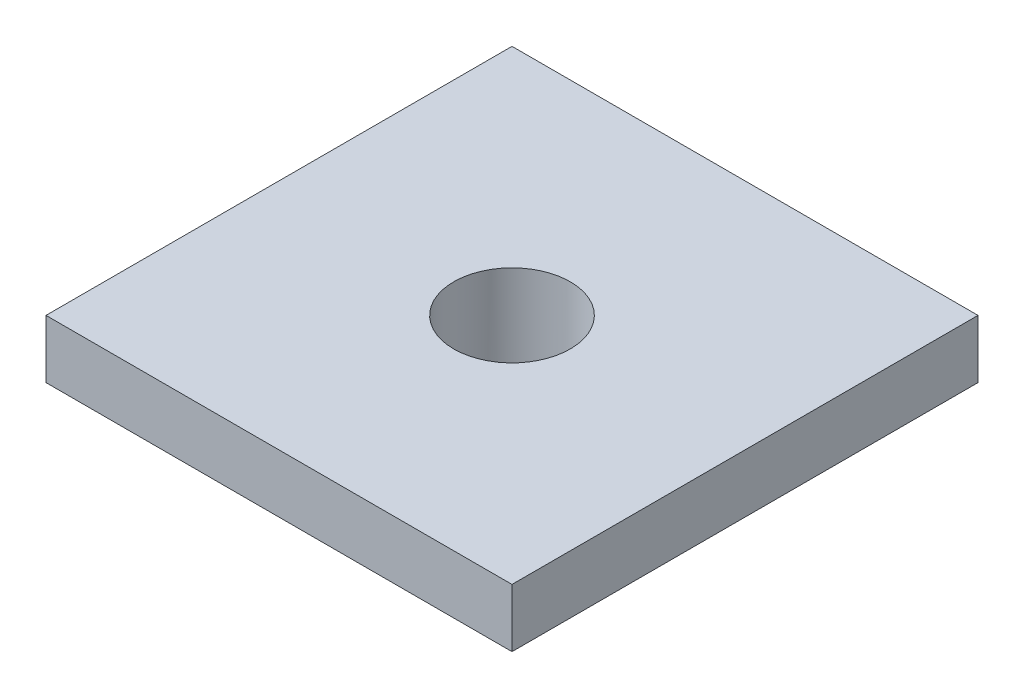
SolidWorks part; units mm, degrees
ref_plane "前视基准面" through (0, 0, 0) normal (0, 0, 1) x (1, 0, 0)
ref_plane "上视基准面" through (0, 0, 0) normal (0, 1, 0) x (1, 0, 0)
ref_plane "右视基准面" through (0, 0, 0) normal (1, 0, 0) x (0, 0, -1)
other "Configuration Table"
sketch "Sk1" plane through (0, 0, 0) normal (0, 1, 0) x (1, 0, 0)
  line L1 (0, 0) -> (80, 0)
  line L2 (0, 0) -> (0, 80)
  line L3 (0, 80) -> (80, 80)
  line L4 (80, 0) -> (80, 80)
extrude "Boss1" add sketch "Sk1" against normal blind 10
sketch "Sk2" plane through (0, 0, 0) normal (0, 1, 0) x (1, 0, 0)
  line L1 (15, 15) -> (65, 15)
  line L2 (15, 15) -> (15, 65)
  line L3 (15, 65) -> (65, 65)
  line L4 (65, 15) -> (65, 65)
extrude "Boss2" add sketch "Sk2" against normal blind 15
sketch "Sk3" plane through (0, 0, 0) normal (0, 1, 0) x (1, 0, 0)
  circle A0 centre (40, 40) radius 10
extrude "Cut3" cut sketch "Sk3" against normal blind 25
